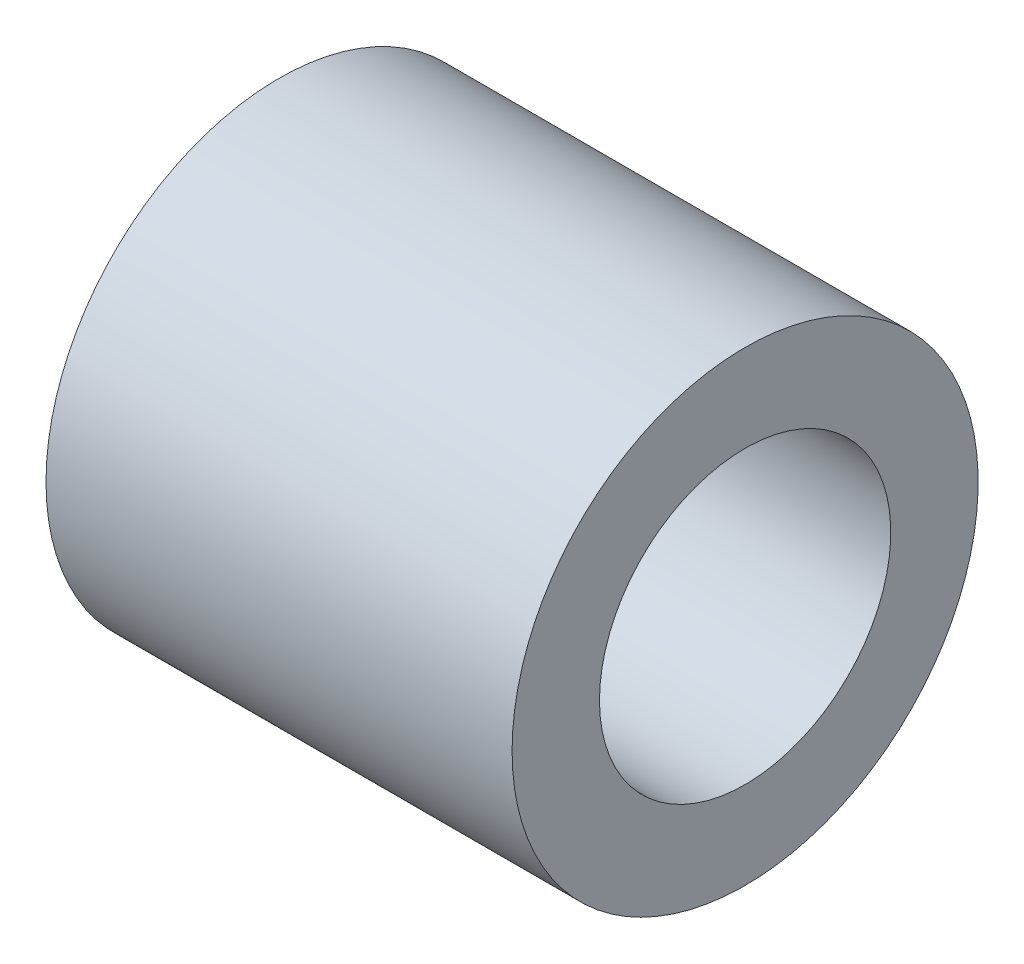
SolidWorks part; units mm, degrees
ref_plane "Ebene1" through (0, 0, 0) normal (0, 0, 1) x (1, 0, 0)
ref_plane "Ebene2" through (0, 0, 0) normal (0, 1, 0) x (1, 0, 0)
ref_plane "Ebene3" through (0, 0, 0) normal (1, 0, 0) x (0, 0, -1)
sketch "Skizze1" plane through (0, 0, 0) normal (0, 0, 1) x (1, 0, 0)
  line L0 (0, 0) -> (25.8525, 0) construction
  line L2 (0, 5) -> (16, 5)
  line L3 (0, 5) -> (0, 8)
  line L4 (0, 8) -> (16, 8)
  line L5 (16, 5) -> (16, 8)
  dimension "D1" = 10
  dimension "D2" = 16
  dimension "D3" = 16
revolve "Rotation2" add sketch "Skizze1" angle 360 about L0
